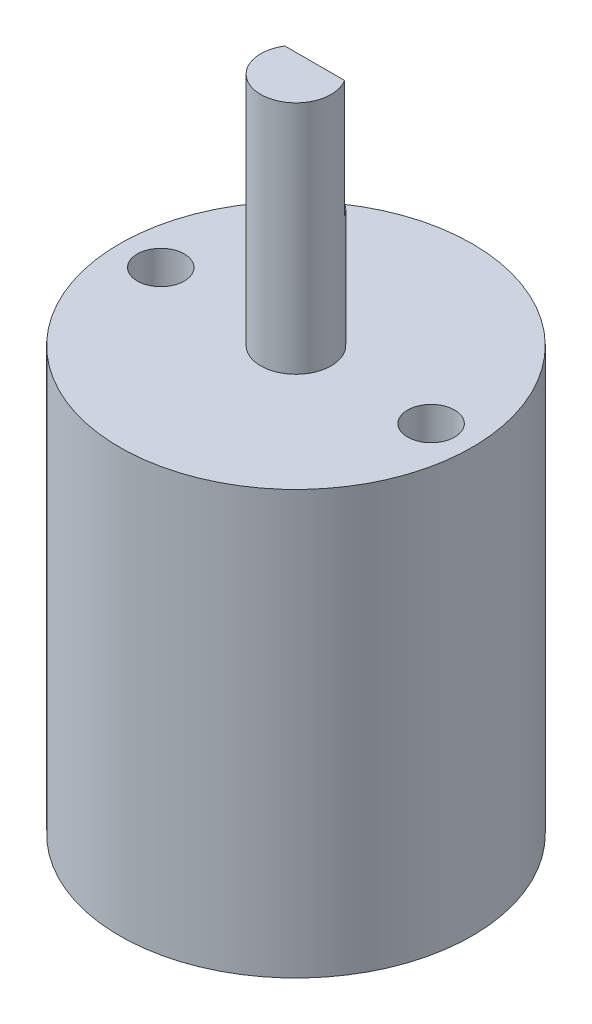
SolidWorks part; units mm, degrees
ref_plane "前视基准面" through (0, 0, 0) normal (0, 0, 1) x (1, 0, 0)
ref_plane "上视基准面" through (0, 0, 0) normal (0, 1, 0) x (1, 0, 0)
ref_plane "右视基准面" through (0, 0, 0) normal (1, 0, 0) x (0, 0, -1)
sketch "草图1" plane through (0, 0, 0) normal (0, 0, 1) x (1, 0, 0)
  line L0 (0, 0) -> (0, 28)
  line L1 (0, 28) -> (1.5, 28)
  line L2 (1.5, 28) -> (1.5, 18)
  line L3 (1.5, 18) -> (7.5, 18)
  line L4 (7.5, 18) -> (7.5, 0)
  line L5 (7.5, 0) -> (0, 0)
  dimension "D1" = 1.5
  dimension "D2" = 7.5
  dimension "D3" = 18
  dimension "D4" = 10
revolve "旋转1" add sketch "草图1" angle 360 about L0
sketch "草图2" plane through (0, 18, 0) normal (0, 1, 0) x (1, 0, 0)
  line L0 (-8.8159, 0) -> (8.6647, 0) construction
  line L1 (0, 0) -> (0, 8.6647) construction
  circle A0 centre (-5.75, 0) radius 1
  circle A1 centre (5.75, 0) radius 1
  dimension "D1" = 2
  dimension "D2" = 11.5
extrude "切除-拉伸1" cut sketch "草图2" against normal blind 5
sketch "草图3" plane through (0, 28, 0) normal (0, 1, 0) x (1, 0, 0)
  line L0 (0, 0) -> (0, 8.0651) construction
  line L1 (-2.5144, 5.1849) -> (2.5144, 5.1849)
  line L2 (-2.5144, 5.1849) -> (-2.5144, 0.8)
  line L3 (-2.5144, 0.8) -> (2.5144, 0.8)
  line L4 (2.5144, 5.1849) -> (2.5144, 0.8)
  line L5 (-2.5144, 5.1849) -> (2.5144, 0.8) construction
  line L6 (-2.5144, 0.8) -> (2.5144, 5.1849) construction
  point P0 (0, 2.9924)
  dimension "D1" = 0.8
extrude "切除-拉伸2" cut sketch "草图3" against normal blind 5
